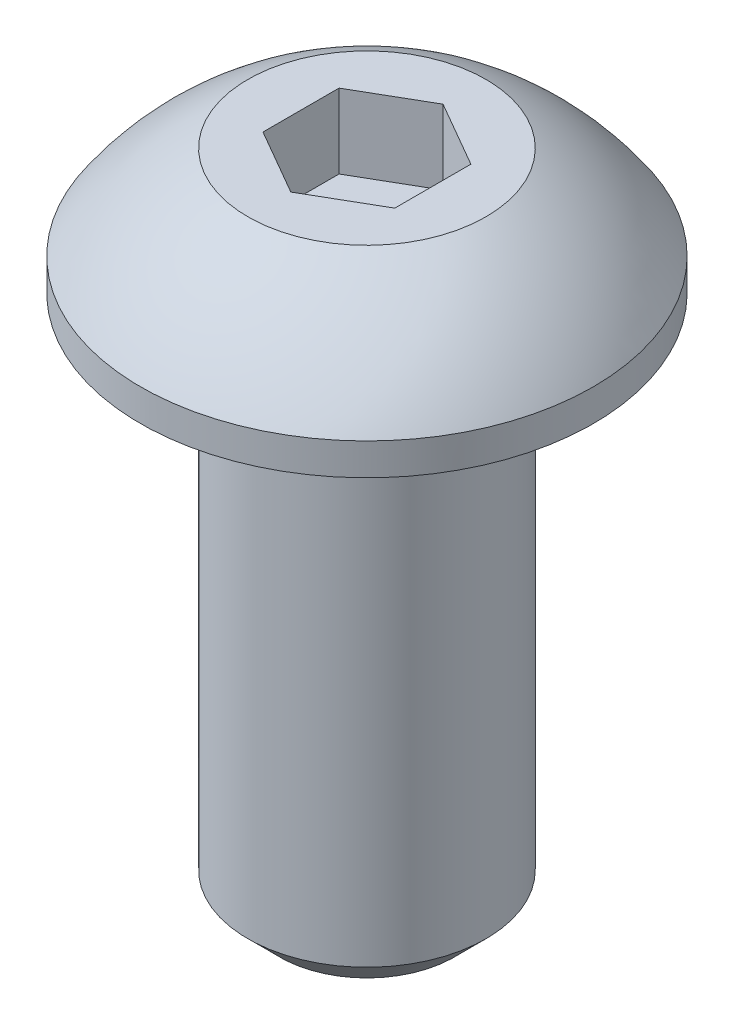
SolidWorks part; units mm, degrees
ref_plane "Front" through (0, 0, 0) normal (0, 0, 1) x (1, 0, 0)
ref_plane "Top" through (0, 0, 0) normal (0, 1, 0) x (1, 0, 0)
ref_plane "Right" through (0, 0, 0) normal (1, 0, 0) x (0, 0, -1)
sketch "Sketch1" plane through (0, 0, 0) normal (0, 0, 1) x (1, 0, 0)
  line L0 (0, 0) -> (2.7051, 0)
  line L1 (2.7051, 0) -> (2.7051, 0.381)
  line L2 (1.4224, 1.4986) -> (0, 1.4986)
  line L3 (0, 1.4986) -> (0, 0)
  line L4 (0, 0) -> (0, 100) construction
  arc A0 (2.7051, 0.381) -> (1.4224, 1.4986) centre (0, -1.4288) ccw
revolve "Base-Revolve" add sketch "Sketch1" angle 360 about L4
sketch "Sketch2" plane through (0, 0, 0) normal (0, 0, 1) x (1, 0, 0)
  line L0 (0, 0) -> (0, 100) construction
  line L1 (0, -6.35) -> (1.0439, -6.35)
  line L2 (1.0439, -6.35) -> (1.4224, -5.9715)
  line L3 (1.4224, -5.9715) -> (1.4224, 0)
  line L4 (1.4224, 0) -> (0, 0)
  line L5 (0, 0) -> (0, -6.35)
revolve "Boss-Revolve1" add sketch "Sketch2" angle 360 about L0
ref_plane "Plane4" through (0, 1.4986, 0) normal (0, 1, 0) x (-1, 0, 0)
sketch "Sketch3" plane through (0, 1.4986, 0) normal (0, 1, 0) x (-1, 0, 0)
  line L0 (0.7874, 0.4546) -> (0, 0.9092)
  line L1 (0, 0.9092) -> (-0.7874, 0.4546)
  line L2 (-0.7874, 0.4546) -> (-0.7874, -0.4546)
  line L3 (-0.7874, -0.4546) -> (0, -0.9092)
  line L4 (0, -0.9092) -> (0.7874, -0.4546)
  line L5 (0.7874, -0.4546) -> (0.7874, 0.4546)
extrude "Cut-Extrude1" cut sketch "Sketch3" against normal blind 0.889
